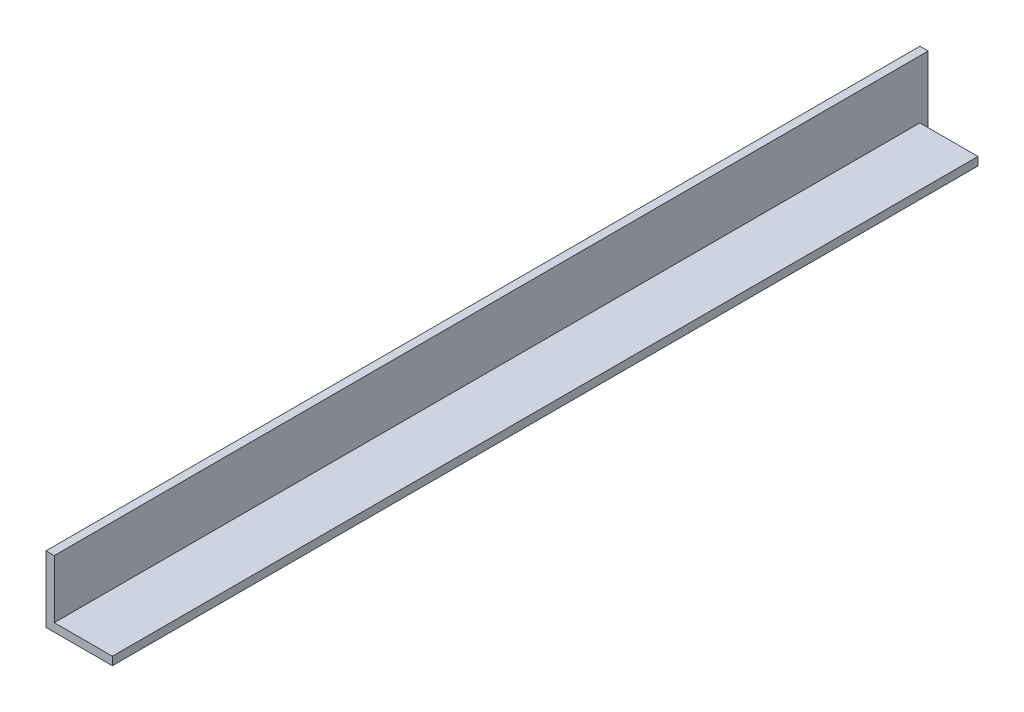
SolidWorks part; units mm, degrees
ref_plane "Front Plane" through (0, 0, 0) normal (0, 0, 1) x (1, 0, 0)
ref_plane "Top Plane" through (0, 0, 0) normal (0, 1, 0) x (1, 0, 0)
ref_plane "Right Plane" through (0, 0, 0) normal (1, 0, 0) x (0, 0, -1)
sketch "Sketch1" plane through (0, 0, 0) normal (0, 0, 1) x (1, 0, 0)
  line L0 (0, 0) -> (0, 38.1)
  line L1 (0, 0) -> (38.1, 0)
  line L2 (38.1, 0) -> (38.1, 4.7498)
  line L3 (38.1, 4.7498) -> (4.7498, 4.7498)
  line L4 (4.7498, 4.7498) -> (4.7498, 38.1)
  line L5 (4.7498, 38.1) -> (0, 38.1)
  dimension "D1" = 38.1
  dimension "D2" = 38.1
  dimension "D3" = 4.7498
  dimension "D4" = 4.7498
extrude "Boss-Extrude1" add sketch "Sketch1" along normal blind 501.65
sketch "Sketch2" plane through (0, 0, 0) normal (0, -1, 0) x (1, 0, 0)
  line L0 (38.1, 501.65) -> (38.1, 0) construction
  line L1 (4.7498, 0) -> (38.1, 0)
  line L2 (4.7498, 0) -> (4.7498, 4.7752)
  line L3 (4.7498, 4.7752) -> (38.1, 4.7752)
  line L4 (38.1, 0) -> (38.1, 4.7752)
  dimension "D1" = 4.7752
extrude "Cut-Extrude1" cut sketch "Sketch2" against normal through all
